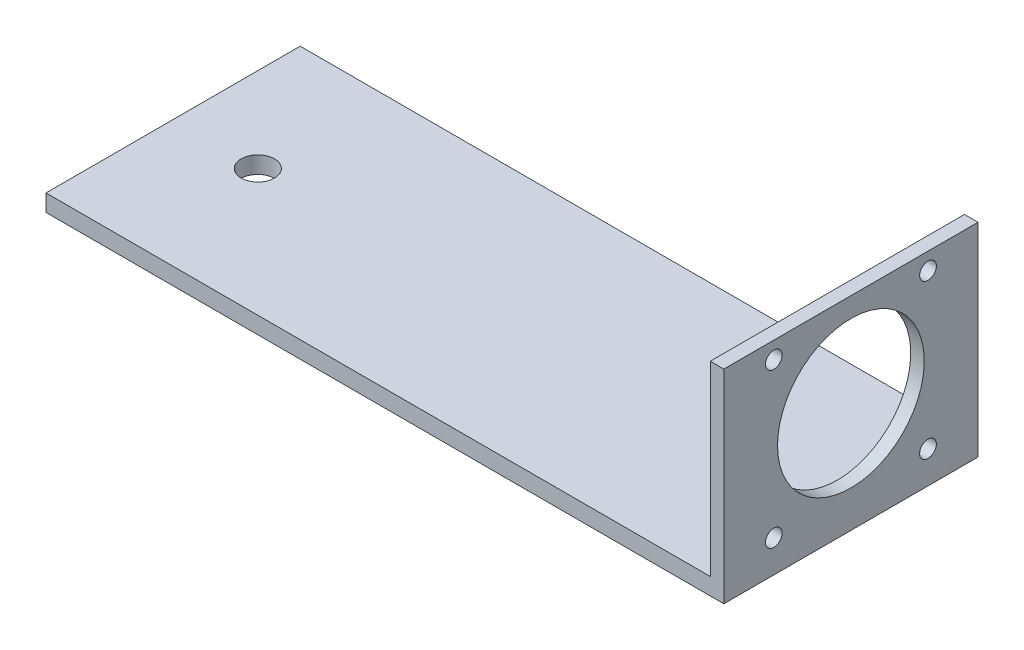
SolidWorks part; units mm, degrees
ref_plane "Front Plane" through (0, 0, 0) normal (0, 0, 1) x (1, 0, 0)
ref_plane "Top Plane" through (0, 0, 0) normal (0, 1, 0) x (1, 0, 0)
ref_plane "Right Plane" through (0, 0, 0) normal (1, 0, 0) x (0, 0, -1)
sketch "Sketch2" plane through (0, 0, 0) normal (0, 1, 0) x (1, 0, 0)
  line L1 (0, 0) -> (101.6, 0)
  line L2 (0, 0) -> (0, 38.1)
  line L3 (0, 38.1) -> (101.6, 38.1)
  line L4 (101.6, 0) -> (101.6, 38.1)
  dimension "D1" = 38.1
  dimension "D2" = 101.6
extrude "Boss-Extrude1" add sketch "Sketch2" along normal blind 2.54
sketch "Sketch3" plane through (101.6, 0, 0) normal (1, 0, 0) x (0, 0, -1)
  line L1 (0, 0) -> (38.1, 0)
  line L2 (0, 0) -> (0, 30.48)
  line L3 (0, 30.48) -> (38.1, 30.48)
  line L4 (38.1, 0) -> (38.1, 30.48)
  dimension "D1" = 38.1
  dimension "D2" = 30.48
extrude "Boss-Extrude2" add sketch "Sketch3" against normal blind 2.032
sketch "Sketch4" plane through (99.568, 0, 0) normal (-1, 0, 0) x (0, 0, 1)
  line L0 (-38.1, 2.54) -> (-38.1, 30.48) construction
  line L1 (-38.1, 30.48) -> (0, 30.48) construction
  circle A0 centre (-19.05, 16.51) radius 10.9982
  dimension "D1" = 21.9964
  dimension "D2" = 19.05
  dimension "D3" = 13.97
extrude "Cut-Extrude1" cut sketch "Sketch4" against normal blind 2.032
sketch "Sketch5" plane through (99.568, 0, 0) normal (-1, 0, 0) x (0, 0, 1)
  line L0 (0, 30.48) -> (0, 0) construction
  line L3 (-38.1, 30.48) -> (0, 30.48) construction
  circle A0 centre (-30.607, 27.94) radius 1.2497
  circle A1 centre (-7.493, 27.94) radius 1.2497
  circle A2 centre (-7.493, 4.826) radius 1.2497
  circle A3 centre (-30.607, 4.826) radius 1.2497
  point P8 (0, 0)
  point P9 (0, 0)
  point P10 (0, 0)
  point P11 (0, 0)
  point P14 (0, 0)
  dimension "D1" = 2.4994
  dimension "D2" = 23.114
  dimension "D3" = 23.114
  dimension "D4" = 7.493
  dimension "D5" = 23.114
  dimension "D6" = 2.54
sketch "Sketch6" plane through (0, 2.54, 0) normal (0, 1, 0) x (1, 0, 0)
  line L0 (0, 0) -> (99.568, 0) construction
  line L1 (0, 38.1) -> (0, 0) construction
  circle A0 centre (12.7, 19.05) radius 2.5
  dimension "D1" = 5
  dimension "D2" = 19.05
  dimension "D3" = 12.7
extrude "Cut-Extrude2" cut sketch "Sketch6" against normal through all
extrude "Cut-Extrude3" cut sketch "Sketch5" against normal up to next
